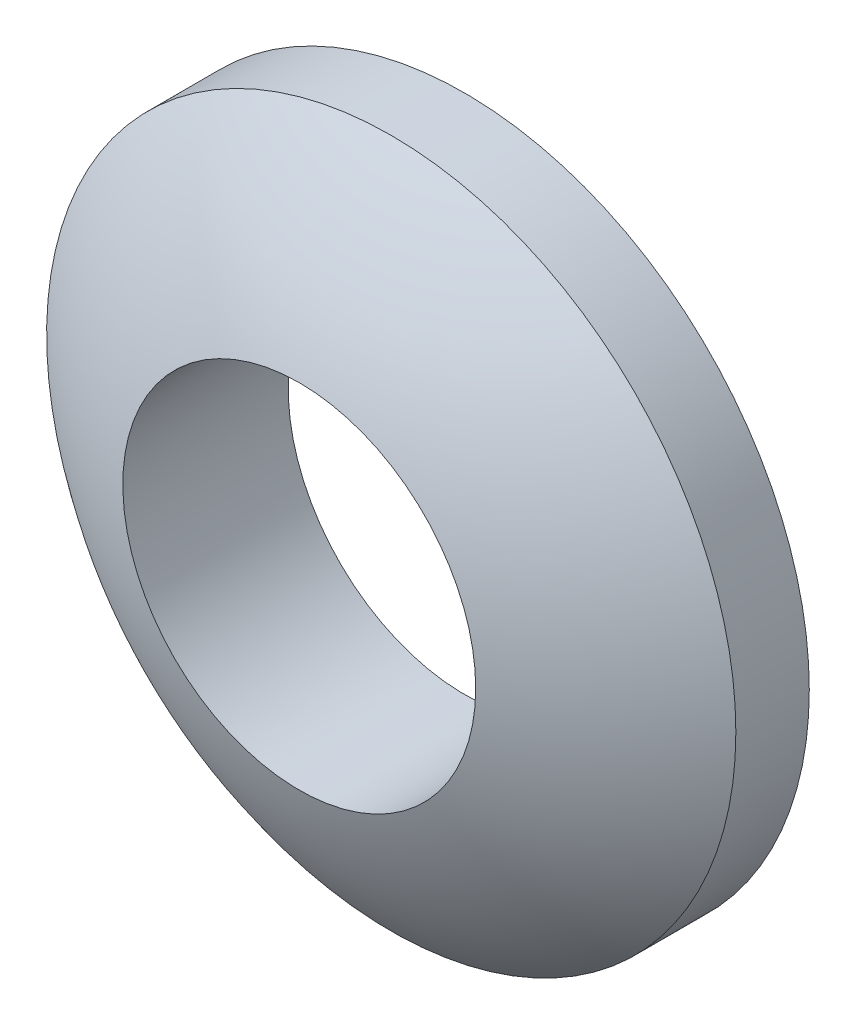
SolidWorks part; units mm, degrees
ref_plane "Front" through (0, 0, 0) normal (0, 0, 1) x (1, 0, 0)
ref_plane "Top" through (0, 0, 0) normal (0, 1, 0) x (1, 0, 0)
ref_plane "Right" through (0, 0, 0) normal (1, 0, 0) x (0, 0, -1)
other "Configuration Table"
sketch "Sketch1" plane through (0, 0, 0) normal (-1, 0, 0) x (0, -1, 0)
  line L0 (-3.2, -3) -> (-6.25, -3)
  line L1 (-6.25, -3) -> (-6.25, -1.6679)
  line L2 (0, 58.0501) -> (0, -42.8594) construction
  line L3 (-3.2, -3) -> (-3.2, 0)
  arc A0 (-3.2, 0) -> (-6.25, -1.6679) centre (0, -9.4742) ccw
  dimension "SR" = 10
  dimension "D0" = 12.5
  dimension "h" = 3
  dimension "d" = 6.4
revolve "Base-Revolve" add sketch "Sketch1" angle 360 about L2
